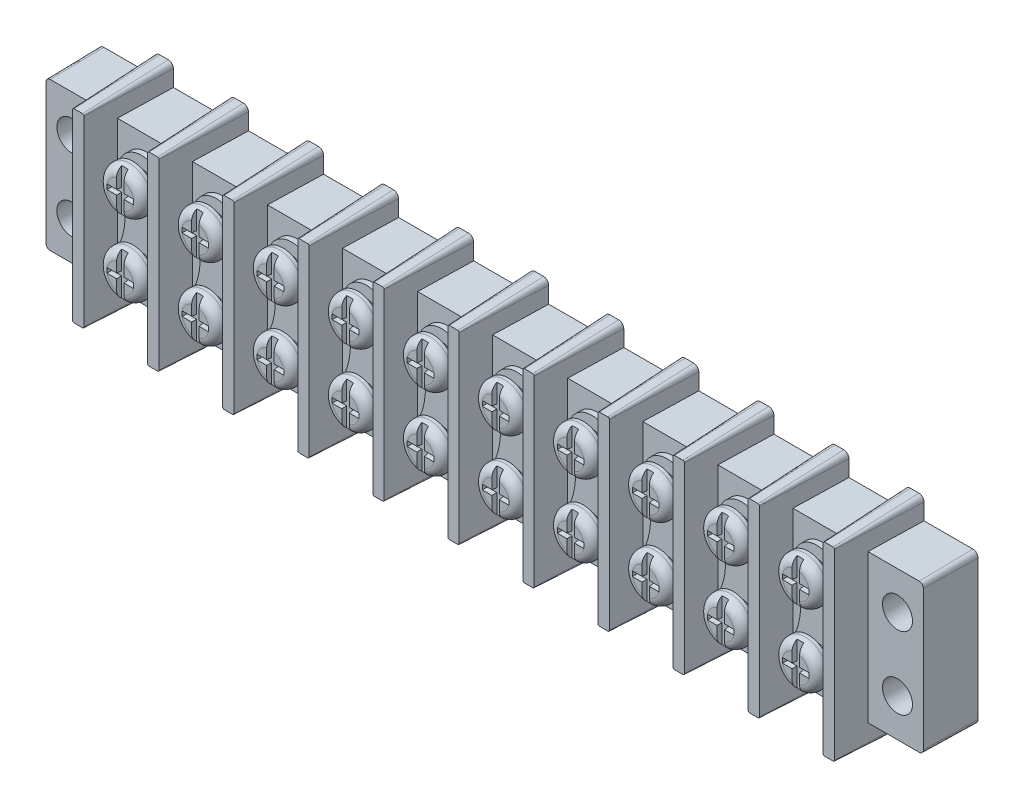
SolidWorks part; units mm, degrees
ref_plane "Plane1" through (0, 0, 0) normal (0, 0, 1) x (1, 0, 0)
ref_plane "Plane2" through (0, 0, 0) normal (0, 1, 0) x (1, 0, 0)
ref_plane "Plane3" through (0, 0, 0) normal (1, 0, 0) x (0, 0, -1)
sketch "BASE Sketch" plane through (0, 0, 0) normal (0, 0, 1) x (1, 0, 0)
  line L1 (-3.9687, 15.7099) -> (-3.9687, -4.9911)
  line L4 (-3.9688, 5.3594) -> (126.2062, 5.3594) construction
  line L5 (61.1187, 5.3594) -> (61.1187, -5.7531) construction
  line L7 (-3.2068, 16.4719) -> (125.4442, 16.4719)
  line L8 (-3.2068, -5.7531) -> (125.4443, -5.7531)
  line L11 (126.2062, 15.7099) -> (126.2062, -4.9911)
  circle A0 centre (0, 0) radius 1.7526 construction
  arc A1 (-3.2068, 16.4719) -> (-3.9687, 15.7099) centre (-3.2068, 15.7099) ccw
  arc A2 (-3.2068, -5.7531) -> (-3.9687, -4.9911) centre (-3.2068, -4.9911) cw
  arc A3 (125.4443, -5.7531) -> (126.2062, -4.9911) centre (125.4443, -4.9911) ccw
  arc A4 (125.4442, 16.4719) -> (126.2062, 15.7099) centre (125.4442, 15.7099) cw
  dimension "SCREW SIZE" = 3.5052
  dimension "GENERAL FILET" = 0.762
  dimension "M" = 122.2375
  dimension "FIRST HOLE FROM END" = 3.9688
  dimension "LENGTH" = 130.175
  dimension "BASE WIDTH" = 22.225
  dimension "HOLE WIDTH" = 10.7188
extrude "BASE" add sketch "BASE Sketch" along normal blind 7.9502 draft 1
sketch "RIB Sketch" plane through (0, 0, 0) normal (0, 0, -1) x (-1, 0, 0)
  line L0 (-5.0664, 19.6469) -> (-6.3237, 19.6469)
  line L1 (-4.3044, 18.8849) -> (-4.3044, -8.1661)
  line L2 (-6.3237, -8.9281) -> (-5.0664, -8.9281)
  line L3 (-7.0857, -8.1661) -> (-7.0857, 18.8849)
  line L4 (-5.695, 19.6469) -> (-5.695, -8.9281) construction
  line L5 (3.83, 5.3594) -> (-4.3044, 5.3594) construction
  line L6 (3.83, 15.7099) -> (3.83, -4.9911) construction
  line L8 (3.83, 15.7099) -> (3.83, -4.9911) construction
  arc A0 (-4.3044, 18.8849) -> (-5.0664, 19.6469) centre (-5.0664, 18.8849) ccw
  arc A1 (-7.0857, 18.8849) -> (-6.3237, 19.6469) centre (-6.3237, 18.8849) cw
  arc A2 (-7.0857, -8.1661) -> (-6.3237, -8.9281) centre (-6.3237, -8.1661) ccw
  arc A3 (-5.0664, -8.9281) -> (-4.3044, -8.1661) centre (-5.0664, -8.1661) ccw
  dimension "D1" = 2.7813
  dimension "D2" = 9.525
  dimension "RIB WIDTH" = 28.575
extrude "RIB" add sketch "RIB Sketch" against normal blind 12.7 draft 2.5
sketch "HOLE Sketch" plane through (0, 0, 0) normal (0, 0, -1) x (-1, 0, 0)
  circle A0 centre (0, 0) radius 2.2225
  dimension "HOLE DIA" = 4.445
extrude "HOLE" cut sketch "HOLE Sketch" against normal through all
pattern_linear "RIB Pattern" count 11 spacing 11.1125 along (1, 0, 0) of "RIB"
pattern_linear "HOLE Pattern" count 12 spacing 11.1125 along (1, 0, 0) count 2 spacing 10.7188 along (0, 1, 0) of "HOLE"
sketch "TERMINAL Sketch" plane through (0, 0, 7.9502) normal (0, 0, 1) x (1, 0, 0)
  line L0 (-3.9688, 5.3594) -> (126.2062, 5.3594) construction
  line L4 (8.7105, 5.3594) -> (13.5145, 5.3594) construction
  line L5 (11.1125, 14.1732) -> (11.1125, -3.4544) construction
  circle A0 centre (11.1125, 10.7188) radius 1.7475
  circle A1 centre (11.1125, 0) radius 1.7475
  arc A2 (14.3104, 9.4126) -> (7.9146, 9.4126) centre (11.1125, 10.7188) ccw
  arc A3 (14.3104, 1.3062) -> (7.9146, 1.3062) centre (11.1125, 0) cw
  arc A4 (7.9146, 9.4126) -> (7.9146, 1.3062) centre (-2.0083, 5.3594) cw
  arc A5 (14.3104, 9.4126) -> (14.3104, 1.3062) centre (24.2333, 5.3594) ccw
  dimension "D5" = 3.495
  dimension "D2" = 3.4544
  dimension "D6" = 10.7188
extrude "TERMINAL" add sketch "TERMINAL Sketch" along normal blind 0.8128
pattern_linear "TERMINAL Pattern" count 10 spacing 11.1125 along (1, 0, 0) of "TERMINAL"
sketch "SCREW Sketch" plane through (0, 0, 0) normal (0, 1, 0) x (1, 0, 0)
  line L0 (12.8651, -10.033) -> (12.8651, -7.9502)
  line L1 (12.8651, -10.033) -> (14.4399, -10.033)
  line L2 (6.7386, -7.9502) -> (15.764, -7.9502) construction
  line L3 (12.8651, -7.9502) -> (11.1125, -7.9502)
  line L4 (11.1125, -7.9502) -> (11.1125, -11.8872)
  line L5 (14.4399, -11.8872) -> (11.1125, -11.8872)
  line L6 (11.1125, -7.9502) -> (11.1125, -6.8704) construction
  line L8 (14.4399, -11.8872) -> (14.4399, -10.033)
  line L9 (9.365, -8.763) -> (12.86, -8.763) construction
  dimension "D1" = 1.27
  dimension "SCREW HEAD THICK" = 1.8542
  dimension "D3" = 11.1125
  dimension "SCREW HEAD DIA" = 6.6548
  dimension "SCREW DIA" = 3.5052
revolve "SCREW" add sketch "SCREW Sketch" angle 360 about L6
fillet "SCREW HEAD FILET" radius 1.3536 1 edges at (14.4399, 0, 11.8872)
sketch "SCREW SLOT Sketch" plane through (0, 0, 11.8872) normal (0, 0, 1) x (1, 0, 0)
  line L0 (10.558, 3.3274) -> (11.667, 3.3274)
  line L1 (10.558, 3.3274) -> (10.558, 0.3697)
  line L2 (11.667, -3.3274) -> (10.558, -3.3274)
  line L3 (11.667, -3.3274) -> (11.667, -0.3697)
  line L4 (9.1387, 0.3697) -> (10.558, 0.3697)
  line L5 (9.1387, 0.3697) -> (9.1387, -0.3697)
  line L6 (13.0863, -0.3697) -> (11.667, -0.3697)
  line L7 (13.0863, -0.3697) -> (13.0863, 0.3697)
  line L8 (11.1125, 3.3274) -> (11.1125, -3.3274) construction
  line L9 (9.1387, 0) -> (13.0863, 0) construction
  line L10 (11.667, 0.3697) -> (11.667, 3.3274)
  line L11 (10.558, -0.3697) -> (10.558, -3.3274)
  line L12 (10.558, -0.3697) -> (9.1387, -0.3697)
  line L13 (11.667, 0.3697) -> (13.0863, 0.3697)
  circle A0 centre (11.1125, 0) radius 3.3274 construction
  circle A1 centre (11.1125, 0) radius 3.3274 construction
  circle A2 centre (11.1125, 0) radius 1.9738 construction
  dimension "SCREW SLOT WIDTH" = 1.1091
  dimension "D2" = 0.7394
extrude "SCREW SLOT" cut sketch "SCREW SLOT Sketch" against normal blind 0.6768 draft 5
pattern_linear "SCREW PATTERN" count 10 spacing 11.1125 along (1, 0, 0) count 2 spacing 10.7188 along (0, 1, 0) of "SCREW SLOT", "SCREW", "SCREW HEAD FILET"
equation "\"SPACING\"=7/16"
equation "\"BARRIER GAP\"=.328"
equation "\"NO OF TERMINALS\"=INT(\"M@BASE Sketch\"/\"SPACING\"-1)"
equation "\"D2@RIB Sketch\" = \"FIRST HOLE FROM END@BASE Sketch\"+\"SPACING\"/2"
equation "\"D1@RIB Sketch\" = \"SPACING\"-\"BARRIER GAP\""
equation "\"D3@RIB Pattern\" = \"SPACING\""
equation "\"D1@RIB Pattern\" = \"NO OF TERMINALS\"+1"
equation "\"D3@HOLE Pattern\" = \"SPACING\""
equation "\"D4@HOLE Pattern\" = \"HOLE WIDTH@BASE Sketch\""
equation "\"D1@HOLE Pattern\" = \"NO OF TERMINALS\"+2"
equation "\"D2@TERMINAL Sketch\" = \"BARRIER GAP\"*.41463"
equation "\"D5@TERMINAL Sketch\" = \"SCREW SIZE@BASE Sketch\"-.0004"
equation "\"D6@TERMINAL Sketch\" = \"HOLE WIDTH@BASE Sketch\""
equation "\"D3@TERMINAL Pattern\" = \"SPACING\""
equation "\"D1@TERMINAL Pattern\" = \"NO OF TERMINALS\""
equation "\"D3@SCREW Sketch\" = \"SPACING\""
equation "\"SCREW HEAD FILLET@SCREW HEAD FILET\" = \"SCREW HEAD THICK@SCREW Sketch\"*.73"
equation "\"SCREW SLOT WIDTH@SCREW SLOT Sketch\" = \"SCREW HEAD DIA@SCREW Sketch\"*.16666"
equation "\"D2@SCREW SLOT Sketch\" = \"SCREW SLOT WIDTH@SCREW SLOT Sketch\"*.66666"
equation "\"D1@SCREW SLOT\" = \"SCREW HEAD FILLET@SCREW HEAD FILET\"/2"
equation "\"D4@SCREW PATTERN\" = \"HOLE WIDTH@BASE Sketch\""
equation "\"D3@SCREW PATTERN\" = \"SPACING\""
equation "\"D1@SCREW PATTERN\" = \"NO OF TERMINALS\""
equation "\"SCREW DIA@SCREW Sketch\" = \"SCREW SIZE@BASE Sketch\""
